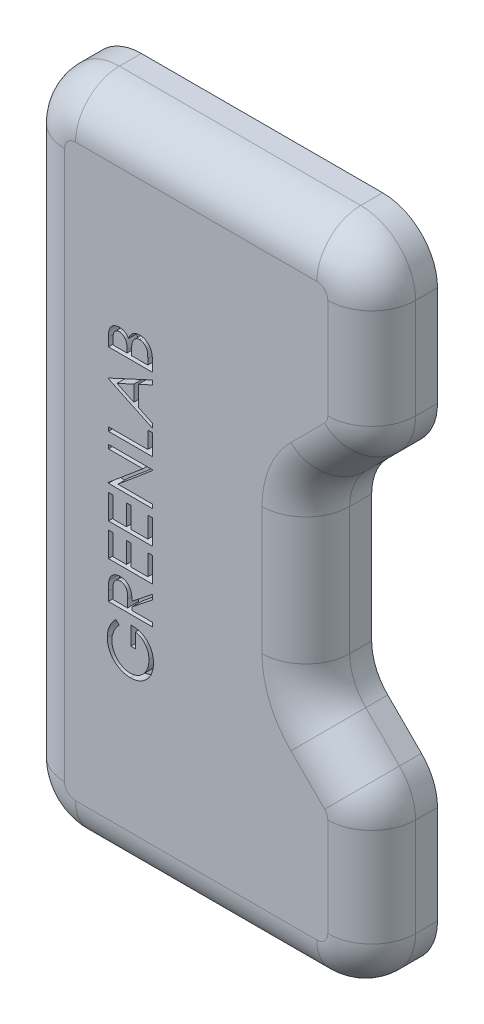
SolidWorks part; units mm, degrees
ref_plane "Front Plane" through (0, 0, 0) normal (0, 0, 1) x (1, 0, 0)
ref_plane "Top Plane" through (0, 0, 0) normal (0, 1, 0) x (1, 0, 0)
ref_plane "Right Plane" through (0, 0, 0) normal (1, 0, 0) x (0, 0, -1)
sketch "Sketch1" plane through (0, 0, 0) normal (0, 0, 1) x (1, 0, 0)
  line L0 (-8, 12.5373) -> (-8, -12.4627)
  line L1 (5, -2.9038) -> (5, 2.9038)
  line L2 (-5.5, -14.9627) -> (5.5, -14.9627)
  line L4 (-5.5, 15.0373) -> (5.5, 15.0373)
  line L5 (8, 7.9749) -> (8, 12.5373)
  line L6 (5.7322, 4.6716) -> (7.2678, 6.2071)
  line L7 (7.2678, -6.2071) -> (5.7322, -4.6716)
  line L8 (8, -12.4627) -> (8, -7.9749)
  arc A0 (5.5, -14.9627) -> (8, -12.4627) centre (5.5, -12.4627) ccw
  arc A1 (8, 12.5373) -> (5.5, 15.0373) centre (5.5, 12.5373) ccw
  arc A2 (-5.5, 15.0373) -> (-8, 12.5373) centre (-5.5, 12.5373) ccw
  arc A3 (-8, -12.4627) -> (-5.5, -14.9627) centre (-5.5, -12.4627) ccw
  arc A4 (8, 7.9749) -> (7.2678, 6.2071) centre (5.5, 7.9749) cw
  arc A5 (5, -2.9038) -> (5.7322, -4.6716) centre (7.5, -2.9038) ccw
  arc A6 (5.7322, 4.6716) -> (5, 2.9038) centre (7.5, 2.9038) ccw
  arc A7 (7.2678, -6.2071) -> (8, -7.9749) centre (5.5, -7.9749) cw
  point P8 (8, -14.9627)
  point P21 (8, 15.0373)
  point P24 (-8, 15.0373)
  point P35 (8, -6.9393)
  dimension "D3" = 2.5
  dimension "D4" = 2.5
  dimension "D5" = 2.5
  dimension "D1" = 16
  dimension "D2" = 30
extrude "Boss-Extrude1" add sketch "Sketch1" along normal blind 3
fillet "Fillet1" radius 2 16 edges at (0, -14.9627, 3) (-7.2678, -14.2305, 3) (-8, 0.0373, 3) (-7.2678, 14.305, 3) (0, 15.0373, 3) (7.2678, 14.305, 3) (8, 10.2561, 3) (7.8097, 7.0182, 3) (6.5, 5.4394, 3) (5.1903, 3.8605, 3) (5, 0, 3) (5.1903, -3.8605, 3) (6.5, -5.4393, 3) (7.8097, -7.0182, 3) (8, -10.2188, 3) (7.2678, -14.2305, 3)
sketch "Sketch2" plane through (0, 0, 3) normal (0, 0, 1) x (1, 0, 0)
  line L0 (-2, -9.8838) -> (-2, 9.9583) construction
  line L1 (-8, -12.4627) -> (-8, 12.5373) construction
  line L2 (-6, 12.5373) -> (-6, -12.4627) construction
  text T0 "GREENLAB" font "Century Gothic" height 2
  point P7 (-6, 0.0373)
  point P8 (-2, 0.0373)
  dimension "D1" = 6
extrude "Cut-Extrude1" cut sketch "Sketch2" against normal blind 0.5
